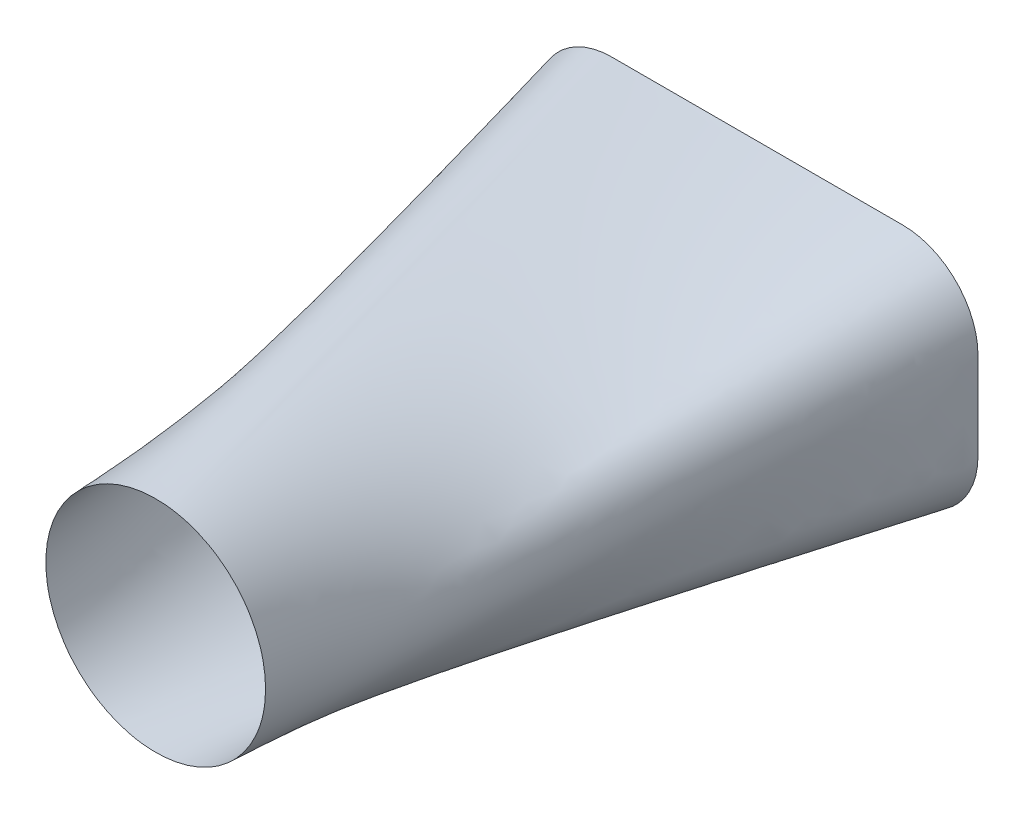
SolidWorks part; units mm, degrees
ref_plane "Front Plane" through (0, 0, 0) normal (0, 0, 1) x (1, 0, 0)
ref_plane "Top Plane" through (0, 0, 0) normal (0, 1, 0) x (1, 0, 0)
ref_plane "Right Plane" through (0, 0, 0) normal (1, 0, 0) x (0, 0, -1)
sketch "Sketch1" plane through (0, 0, 0) normal (0, 0, 1) x (1, 0, 0)
  circle A0 centre (0, 0) radius 14.61
ref_plane "Plane1" through (0, 0, -80) normal (0, 0, 1) x (1, 0, 0)
sketch "Sketch2" plane through (0, 0, -80) normal (0, 0, 1) x (1, 0, 0)
  line L0 (0, 21.9023) -> (0, -30.988) construction
  line L1 (-19.3561, 15.8033) -> (19.3561, 15.8033)
  line L2 (-29.3561, 5.8033) -> (-29.3561, -5.8033)
  line L3 (-19.3561, -15.8033) -> (19.3561, -15.8033)
  line L4 (29.3561, 5.8033) -> (29.3561, -5.8033)
  line L5 (-34.4339, 0) -> (32.7292, 0) construction
  arc A0 (-29.3561, -5.8033) -> (-19.3561, -15.8033) centre (-19.3561, -5.8033) ccw
  arc A1 (19.3561, -15.8033) -> (29.3561, -5.8033) centre (19.3561, -5.8033) ccw
  arc A2 (29.3561, 5.8033) -> (19.3561, 15.8033) centre (19.3561, 5.8033) ccw
  arc A3 (-29.3561, 5.8033) -> (-19.3561, 15.8033) centre (-19.3561, 5.8033) cw
  dimension "D1" = 10
other "Boundary-Surface2"
